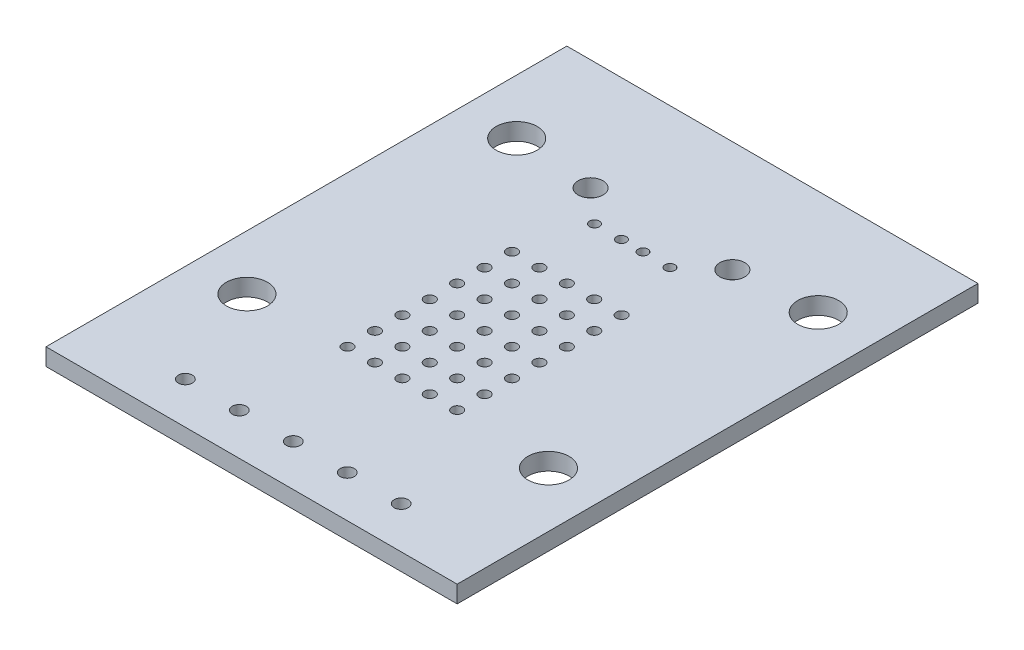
SolidWorks part; units mm, degrees
ref_plane "Front Plane" through (0, 0, 0) normal (0, 0, 1) x (1, 0, 0)
ref_plane "Top Plane" through (0, 0, 0) normal (0, 1, 0) x (1, 0, 0)
ref_plane "Right Plane" through (0, 0, 0) normal (1, 0, 0) x (0, 0, -1)
sketch "Sketch1" plane through (0, 0, 0) normal (0, 1, 0) x (1, 0, 0)
  line L1 (-19.05, 48.26) -> (19.05, 48.26)
  line L2 (-19.05, 48.26) -> (-19.05, 0)
  line L3 (-19.05, 0) -> (19.05, 0)
  line L4 (19.05, 48.26) -> (19.05, 0)
  point P4 (0, 0)
  dimension "D1" = 38.1
  dimension "D2" = 48.26
extrude "Boss-Extrude1" add sketch "Sketch1" along normal blind 1.5875
sketch "Sketch2"
  line L0 (-19.05, 0) -> (19.05, 0) construction
  line L1 (0, 0) -> (0, 48.26) construction
  line L2 (19.05, 48.26) -> (-19.05, 48.26) construction
  circle A0 centre (-13.97, 13.5382) radius 1.905
  circle A1 centre (-13.97, 38.5343) radius 1.905
  circle A2 centre (-10, 3.8633) radius 0.65
  circle A3 centre (-5.0013, 3.8633) radius 0.65
  circle A4 centre (0, 3.8633) radius 0.65
  circle A5 centre (13.97, 38.5343) radius 1.905
  circle A6 centre (13.97, 13.5382) radius 1.905
  circle A8 centre (5.0013, 3.8633) radius 0.65
  circle A9 centre (10, 3.8633) radius 0.65
other "AlignGroup1" parameters "D1"=2.9209, "D2"=2.4096, "D3"=0, "D4"=3.8633, "D5"=13.5382, "D6"=38.5343, "D7"=0, "D8"=0, "D9"=5.0013, "D10"=10, "D11"=13.97
other "AlignGroup2"
extrude "Cut-Extrude1" cut sketch "Sketch2" against normal through all
sketch "Sketch3" plane through (0, 1.5875, 0) normal (0, 1, 0) x (1, 0, 0)
  line L0 (-19.05, 0) -> (19.05, 0) construction
  line L1 (-5.08, 13.97) -> (-2.54, 13.97) construction
  line L2 (-5.08, 13.97) -> (-5.08, 16.51) construction
  circle A0 centre (-5.08, 13.97) radius 0.4953
  circle A1 centre (-2.54, 13.97) radius 0.4953
  circle A2 centre (0, 13.97) radius 0.4953
  circle A3 centre (2.54, 13.97) radius 0.4953
  circle A4 centre (5.08, 13.97) radius 0.4953
  circle A6 centre (-2.54, 16.51) radius 0.4953
  circle A7 centre (0, 16.51) radius 0.4953
  circle A8 centre (2.54, 16.51) radius 0.4953
  circle A9 centre (5.08, 16.51) radius 0.4953
  circle A11 centre (-2.54, 19.05) radius 0.4953
  circle A12 centre (0, 19.05) radius 0.4953
  circle A13 centre (2.54, 19.05) radius 0.4953
  circle A14 centre (5.08, 19.05) radius 0.4953
  circle A16 centre (-2.54, 21.59) radius 0.4953
  circle A17 centre (0, 21.59) radius 0.4953
  circle A18 centre (2.54, 21.59) radius 0.4953
  circle A19 centre (5.08, 21.59) radius 0.4953
  circle A21 centre (-2.54, 24.13) radius 0.4953
  circle A22 centre (0, 24.13) radius 0.4953
  circle A23 centre (2.54, 24.13) radius 0.4953
  circle A24 centre (5.08, 24.13) radius 0.4953
  circle A26 centre (-2.54, 26.67) radius 0.4953
  circle A27 centre (0, 26.67) radius 0.4953
  circle A28 centre (2.54, 26.67) radius 0.4953
  circle A29 centre (5.08, 26.67) radius 0.4953
  circle A31 centre (-2.54, 29.21) radius 0.4953
  circle A32 centre (0, 29.21) radius 0.4953
  circle A33 centre (2.54, 29.21) radius 0.4953
  circle A34 centre (5.08, 29.21) radius 0.4953
  circle A36 centre (-5.08, 16.51) radius 0.4953
  circle A37 centre (-5.08, 19.05) radius 0.4953
  circle A38 centre (-5.08, 21.59) radius 0.4953
  circle A39 centre (-5.08, 24.13) radius 0.4953
  circle A40 centre (-5.08, 26.67) radius 0.4953
  circle A41 centre (-5.08, 29.21) radius 0.4953
  dimension "D1" = 0.9906
  dimension "D3" = 13.97
  dimension "D2" = 5.08
  dimension "D6" = 2.54
  dimension "D7" = 2.54
  dimension "D4" = 5
  dimension "D5" = 7
extrude "Cut-Extrude2" cut sketch "Sketch3" against normal through all
sketch "Sketch4" plane through (0, 1.5875, 0) normal (0, 1, 0) x (1, 0, 0)
  line L0 (0, 0) -> (0, 48.26) construction
  line L1 (19.05, 48.26) -> (-19.05, 48.26) construction
  line L2 (-19.05, 0) -> (19.05, 0) construction
  circle A0 centre (-6.571, 37.9806) radius 1.15
  circle A1 centre (-3.5001, 35.2704) radius 0.4572
  circle A2 centre (-1.0008, 35.2704) radius 0.4572
  circle A3 centre (6.571, 37.9806) radius 1.15
  circle A4 centre (1.0008, 35.2704) radius 0.4572
  circle A5 centre (3.5001, 35.2704) radius 0.4572
  dimension "D1" = 0.9144
  dimension "D5" = 35.2704
  dimension "D7" = 2.3
  dimension "D2" = 1.0008
  dimension "D3" = 3.5001
  dimension "D4" = 6.571
  dimension "D6" = 37.9806
extrude "Cut-Extrude3" cut sketch "Sketch4" against normal through all
